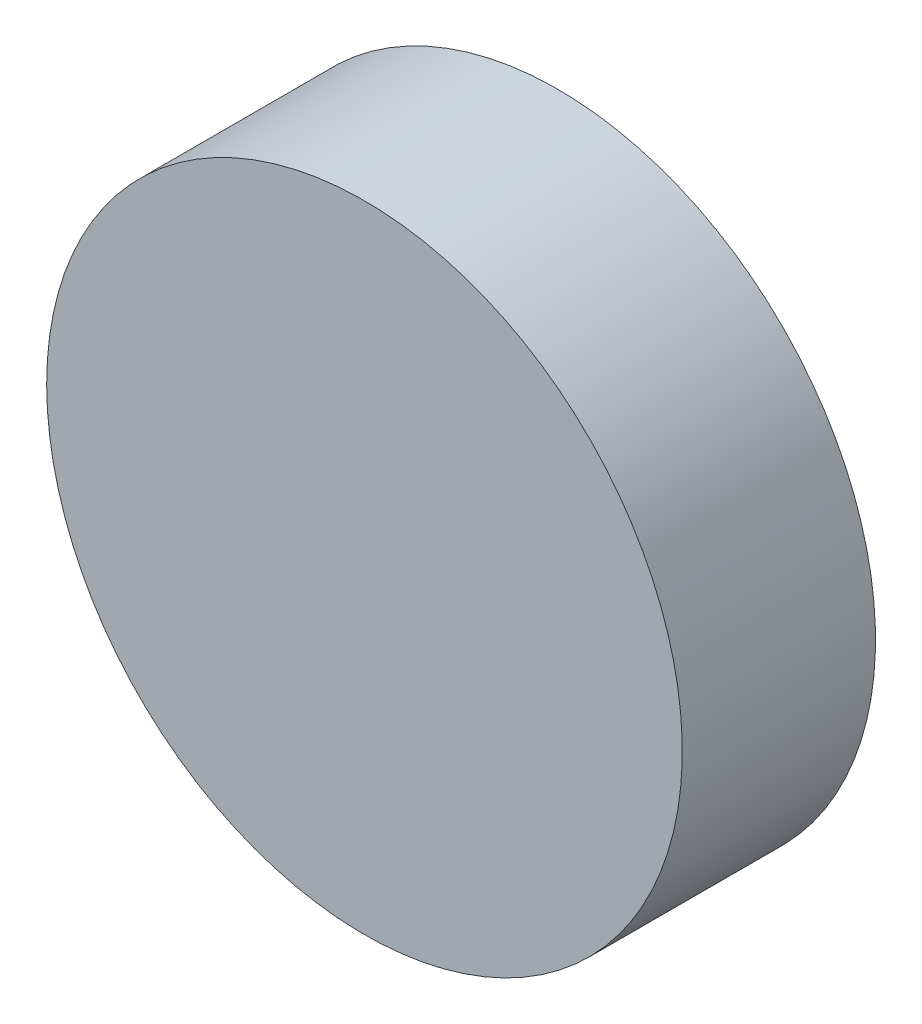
SolidWorks part; units mm, degrees
ref_plane "Спереди" through (0, 0, 0) normal (0, 0, 1) x (1, 0, 0)
ref_plane "Сверху" through (0, 0, 0) normal (0, 1, 0) x (1, 0, 0)
ref_plane "Справа" through (0, 0, 0) normal (1, 0, 0) x (0, 0, -1)
sketch "Эскиз1" plane through (0, 0, 0) normal (0, 0, 1) x (1, 0, 0)
  circle A0 centre (0, 0) radius 6.25
  dimension "D1" = 12.5
extrude "Бобышка-Вытянуть1" add sketch "Эскиз1" along normal blind 3.8
